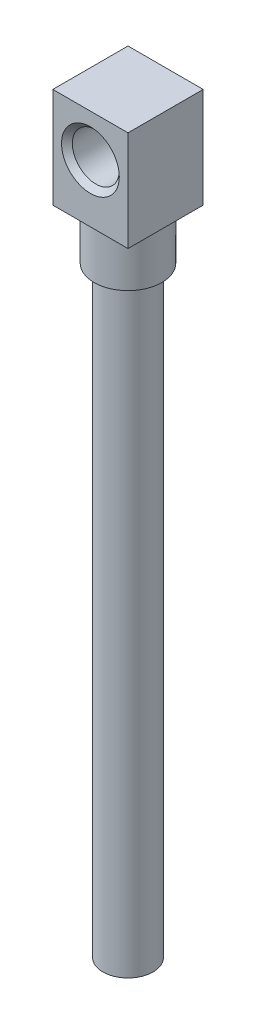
SolidWorks part; units mm, degrees
ref_plane "Front Plane" through (0, 0, 0) normal (0, 0, 1) x (1, 0, 0)
ref_plane "Top Plane" through (0, 0, 0) normal (0, 1, 0) x (1, 0, 0)
ref_plane "Right Plane" through (0, 0, 0) normal (1, 0, 0) x (0, 0, -1)
sketch "Sketch1" plane through (0, 0, 0) normal (0, 1, 0) x (1, 0, 0)
  line L1 (-9.525, 9.525) -> (9.525, 9.525)
  line L2 (-9.525, 9.525) -> (-9.525, -9.525)
  line L3 (-9.525, -9.525) -> (9.525, -9.525)
  line L4 (9.525, 9.525) -> (9.525, -9.525)
  point P4 (0, 9.525)
  point P6 (-9.525, 0)
  dimension "D1" = 19.05
extrude "Boss-Extrude1" add sketch "Sketch1" along normal blind 25.4
sketch "Sketch2" plane through (0, 0, 0) normal (0, -1, 0) x (1, 0, 0)
  circle A0 centre (0, 0) radius 8.5725
extrude "Boss-Extrude2" add sketch "Sketch2" along normal blind 12.7
sketch "Sketch3" plane through (0, -12.7, 0) normal (0, -1, 0) x (1, 0, 0)
  circle A0 centre (0, 0) radius 6.35
extrude "Boss-Extrude3" add sketch "Sketch3" along normal blind 152.4
hole_wizard "1/4-18 NPSM Tapped Hole1" positions "Sketch4" profile "Sketch5" tap size "1/4-18 NPSM" standard "ANSI Inch"
sketch "Sketch4" plane through (0, 0, 9.525) normal (0, 0, 1) x (1, 0, 0)
  point P0 (0, 14.654)
sketch "Sketch5" plane through (0, 14.654, 9.525) normal (1, 0, 0) x (0, -1, 0)
  line L0 (0, 0) -> (0, 19.05)
  line L1 (0, 19.05) -> (5.9436, 19.05)
  line L2 (5.9436, 19.05) -> (5.9436, 1.3716)
  line L3 (5.9436, 1.3716) -> (7.3152, 0)
  line L5 (7.3152, 0) -> (0, 0)
  line L6 (-5.9436, 1.3716) -> (-7.3152, 0) construction
  line L11 (0, -6.35) -> (0, 107.95) construction
  dimension "Thru Tap Drill Dia." = 11.8872
  dimension "Thru Tap Drill Depth" = 19.05
  dimension "Near C'Sink Dia." = 14.6304
  dimension "Near C'Sink Angle" = 90
